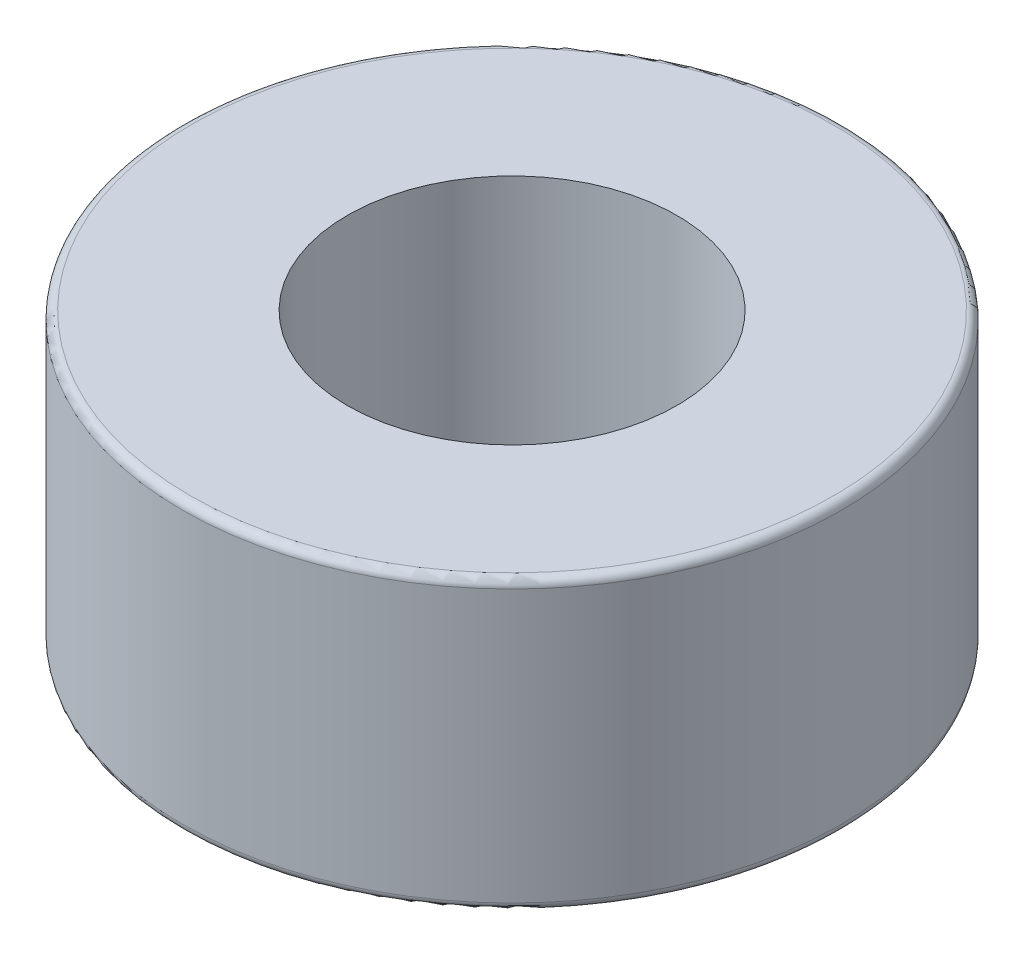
SolidWorks part; units mm, degrees
ref_plane "Front Plane" through (0, 0, 0) normal (0, 0, 1) x (1, 0, 0)
ref_plane "Top Plane" through (0, 0, 0) normal (0, 1, 0) x (1, 0, 0)
ref_plane "Right Plane" through (0, 0, 0) normal (1, 0, 0) x (0, 0, -1)
sketch "Sketch1" plane through (0, 0, 0) normal (0, 1, 0) x (1, 0, 0)
  circle A0 centre (0, 0) radius 8
  circle A1 centre (0, 0) radius 4
  dimension "D1" = 16
  dimension "D2" = 8
extrude "Boss-Extrude1" add sketch "Sketch1" along normal blind 7
fillet "Fillet1" radius 0.2 2 edges at (0, 0, 8) (0, 7, 8)
